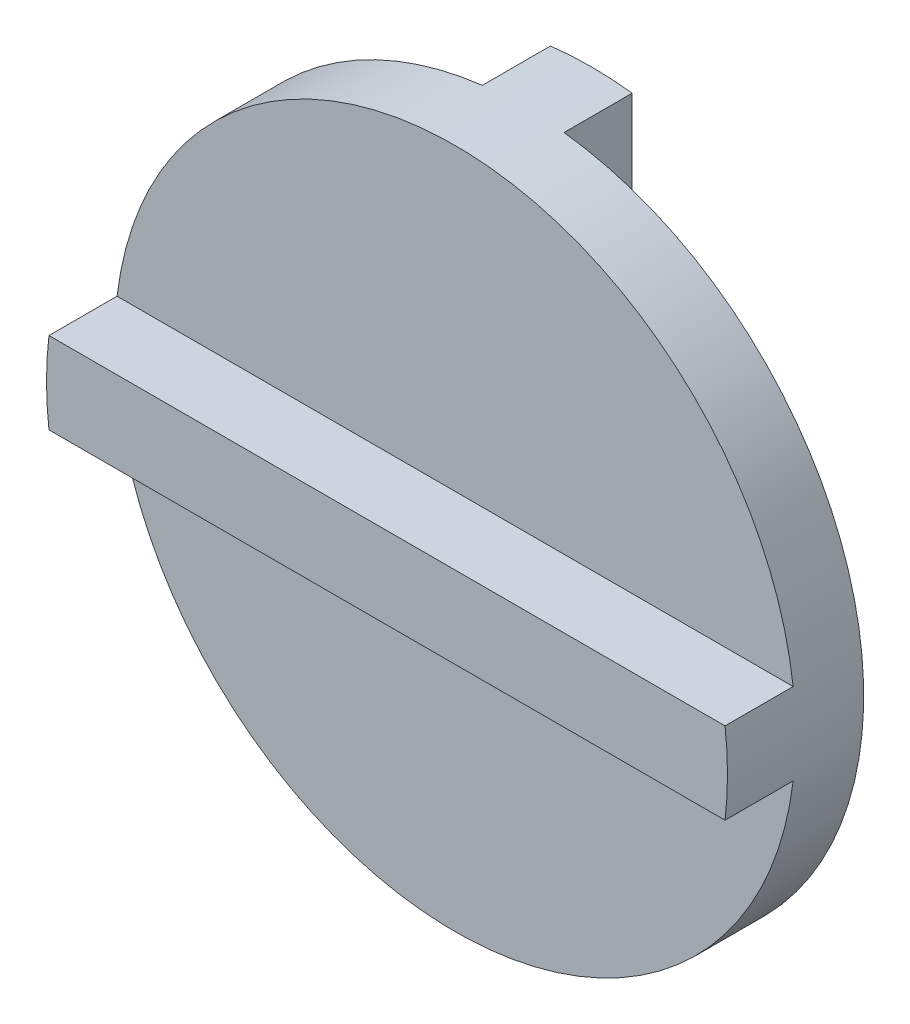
SolidWorks part; units mm, degrees
ref_plane "Front Plane" through (0, 0, 0) normal (0, 0, 1) x (1, 0, 0)
ref_plane "Top Plane" through (0, 0, 0) normal (0, 1, 0) x (1, 0, 0)
ref_plane "Right Plane" through (0, 0, 0) normal (1, 0, 0) x (0, 0, -1)
sketch "Sketch1" plane through (0, 0, 0) normal (0, 0, 1) x (1, 0, 0)
  circle A0 centre (0, 0) radius 50
  dimension "D1" = 100
extrude "Boss-Extrude1" add sketch "Sketch1" along normal blind 10 contours A0
sketch "Sketch2" plane through (0, 0, 10) normal (0, 0, 1) x (1, 0, 0)
  line L0 (-49.6387, 6) -> (49.6387, 6)
  line L1 (-49.6387, -6) -> (49.6387, -6)
  circle A0 centre (0, 0) radius 50 construction
  arc A1 (-49.6387, 6) -> (-49.6387, -6) centre (0, 0) ccw
  arc A2 (49.6387, -6) -> (49.6387, 6) centre (0, 0) ccw
  dimension "D1" = 12
extrude "Boss-Extrude2" add sketch "Sketch2" along normal blind 10
sketch "Sketch3" plane through (0, 0, 0) normal (0, 0, -1) x (-1, 0, 0)
  line L0 (-6, 49.6387) -> (-6, -49.6387)
  line L1 (6, 49.6387) -> (6, -49.6387)
  circle A0 centre (0, 0) radius 50 construction
  arc A1 (-6, -49.6387) -> (6, -49.6387) centre (0, 0) ccw
  arc A2 (6, 49.6387) -> (-6, 49.6387) centre (0, 0) ccw
  dimension "D1" = 12
extrude "Boss-Extrude3" add sketch "Sketch3" along normal blind 10
